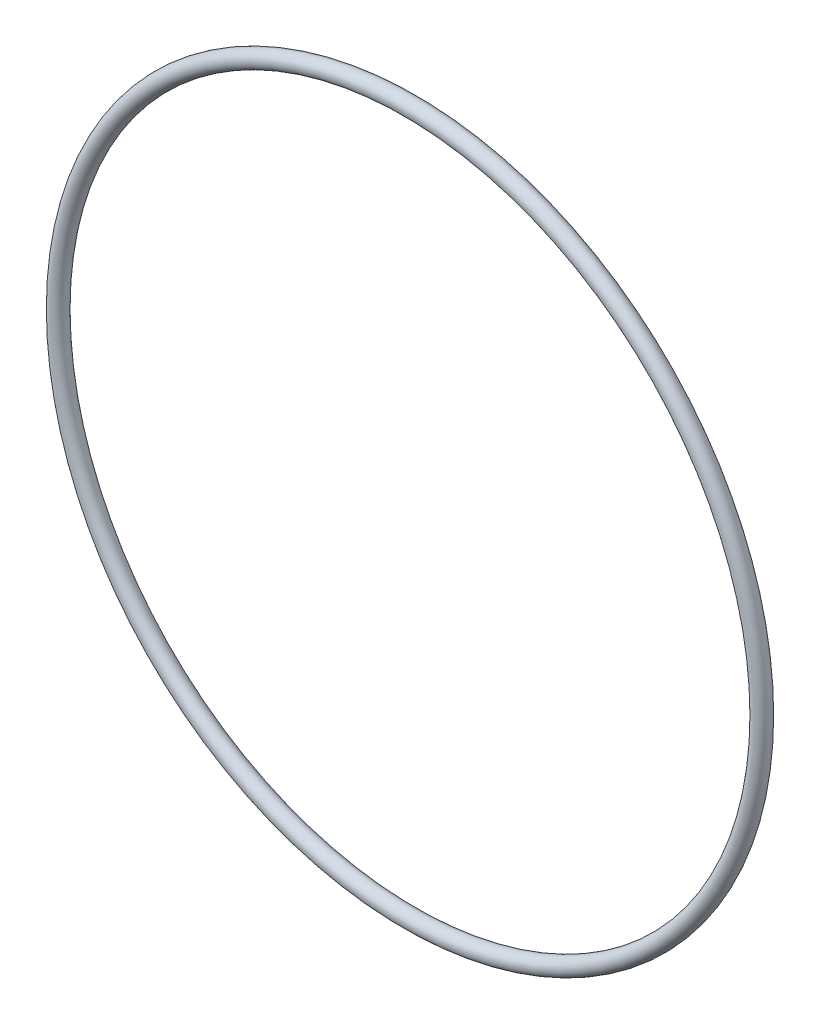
SolidWorks part; units mm, degrees
ref_plane "Front Plane" through (0, 0, 0) normal (0, 0, 1) x (1, 0, 0)
ref_plane "Top Plane" through (0, 0, 0) normal (0, 1, 0) x (1, 0, 0)
ref_plane "Right Plane" through (0, 0, 0) normal (1, 0, 0) x (0, 0, -1)
sketch "Sketch1" plane through (0, 0, 0) normal (0, 1, 0) x (1, 0, 0)
  circle A0 centre (0, 0) radius 0.889
  dimension "D1" = 1.778
sketch "Sketch3" plane through (0, 0, 0) normal (0, 0, 1) x (1, 0, 0)
  circle A0 centre (37.2618, 0) radius 37.2618
  dimension "D1" = 74.5236
sweep "Sweep1" add profiles "Sketch1" path "Sketch3"
